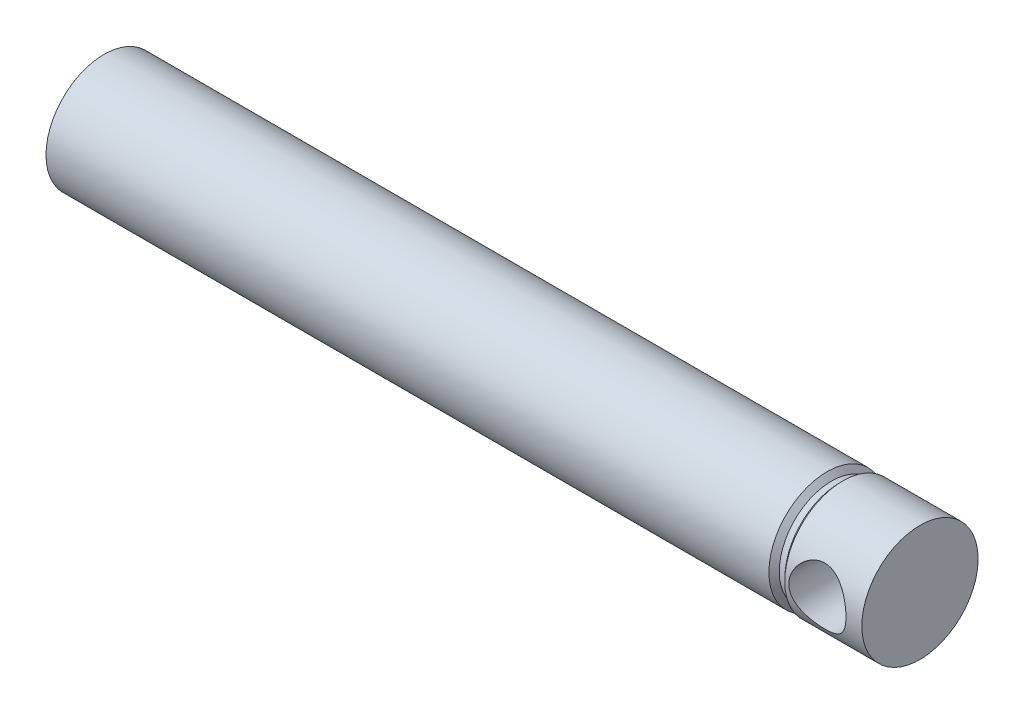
SolidWorks part; units mm, degrees
ref_plane "Plan1" through (0, 0, 0) normal (0, 0, 1) x (1, 0, 0)
ref_plane "Plan2" through (0, 0, 0) normal (0, 1, 0) x (1, 0, 0)
ref_plane "Plan3" through (0, 0, 0) normal (1, 0, 0) x (0, 0, -1)
sketch "Esquisse1" plane through (0, 0, 0) normal (0, 0, 1) x (1, 0, 0)
  line L0 (-110, 0) -> (100, 0) construction
  line L1 (90, 0) -> (90, 14.25)
  line L2 (90, 14.25) -> (71.1, 14.25)
  line L3 (71.1, 14.25) -> (70.253, 13.3606)
  line L4 (70.253, 13.3606) -> (68.3354, 12.8279)
  line L5 (68.3354, 12.8279) -> (67.2167, 14.25)
  line L6 (67.2167, 14.25) -> (-110, 14.25)
  line L7 (-110, 14.25) -> (-110, 0)
  line L8 (90, 0) -> (-110, 0)
  dimension "D1" = 14.25
  dimension "D2" = 14.25
  dimension "D3" = 18.9
  dimension "D4" = 200
revolve "Base-Révolution" add sketch "Esquisse1" angle 360 about L0
sketch "Esquisse2" plane through (0, 0, 0) normal (0, 0, 1) x (1, 0, 0)
  line L0 (-110, 0) -> (100, 0) construction
  line L1 (90, -14.25) -> (90, 14.25) construction
  line L2 (79.1, 0) -> (86.1, 0) construction
  line L3 (86.1, -1.5) -> (86.1, 1.5) construction
  line L4 (79.1, 0) -> (79.1, 7) construction
  line L6 (72.1, -1.5) -> (72.1, 1.5) construction
  circle A0 centre (79.1, 0) radius 7
  arc A1 (86.1, 1.5) -> (72.1, 1.5) centre (79.1, 1.5) ccw construction
  arc A2 (86.1, -1.5) -> (72.1, -1.5) centre (79.1, -1.5) cw construction
  dimension "D1" = 14
  dimension "D2" = 10.9
  dimension "D3" = 3
extrude "Enlèv. mat.-Extru.1" cut sketch "Esquisse2" against normal mid plane 29
